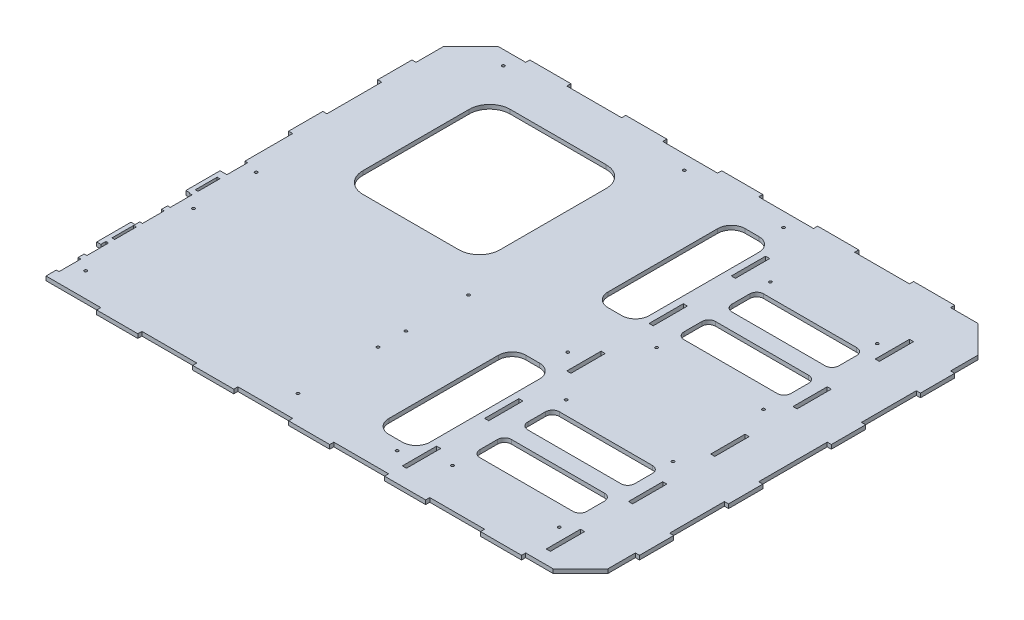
SolidWorks part; units mm, degrees
ref_plane "Front Plane" through (0, 0, 0) normal (0, 0, 1) x (1, 0, 0)
ref_plane "Top Plane" through (0, 0, 0) normal (0, 1, 0) x (1, 0, 0)
ref_plane "Right Plane" through (0, 0, 0) normal (1, 0, 0) x (0, 0, -1)
sketch "Sketch1" plane through (0, 0, 0) normal (0, 1, 0) x (1, 0, 0)
  line L0 (0, 0) -> (0, 310)
  line L1 (0, 310) -> (390, 310)
  line L2 (390, 310) -> (390, 0)
  line L3 (390, 0) -> (0, 0)
extrude "Boss-Extrude1" add sketch "Sketch1" along normal blind 3
sketch "Sketch2" plane through (0, 3, 0) normal (0, 1, 0) x (1, 0, 0)
  line L0 (0, 310) -> (40, 310) construction
  line L1 (390, 310) -> (0, 310) construction
  line L2 (40, 310) -> (70, 310) construction
  line L3 (70, 310) -> (110, 310) construction
  line L4 (110, 310) -> (140, 310) construction
  line L5 (140, 310) -> (180, 310) construction
  line L6 (180, 310) -> (210, 310) construction
  line L7 (210, 310) -> (250, 310) construction
  line L8 (250, 310) -> (280, 310) construction
  line L9 (280, 310) -> (320, 310) construction
  line L10 (320, 310) -> (350, 310) construction
  line L11 (350, 310) -> (390, 310) construction
  line L12 (40, 310) -> (40, 303)
  line L13 (40, 303) -> (70, 303)
  line L14 (70, 303) -> (70, 310)
  line L15 (70, 310) -> (40, 310)
  line L16 (110, 310) -> (110, 303)
  line L17 (110, 303) -> (140, 303)
  line L18 (140, 303) -> (140, 310)
  line L19 (140, 310) -> (110, 310)
  line L20 (180, 310) -> (180, 303)
  line L21 (180, 303) -> (210, 303)
  line L22 (210, 303) -> (210, 310)
  line L23 (210, 310) -> (180, 310)
  line L24 (250, 310) -> (250, 303)
  line L25 (250, 303) -> (280, 303)
  line L26 (280, 303) -> (280, 310)
  line L27 (280, 310) -> (250, 310)
  line L28 (320, 310) -> (320, 303)
  line L29 (320, 303) -> (350, 303)
  line L30 (350, 303) -> (350, 310)
  line L31 (350, 310) -> (320, 310)
  line L32 (0, 155) -> (390, 155) construction
  line L33 (0, 310) -> (0, 0) construction
  line L34 (390, 0) -> (390, 310) construction
  line L35 (350, 0) -> (320, 0)
  line L36 (350, 7) -> (350, 0)
  line L37 (320, 7) -> (350, 7)
  line L38 (320, 0) -> (320, 7)
  line L39 (280, 7) -> (280, 0)
  line L40 (280, 0) -> (250, 0)
  line L41 (250, 0) -> (250, 7)
  line L42 (250, 7) -> (280, 7)
  line L43 (210, 7) -> (210, 0)
  line L44 (210, 0) -> (180, 0)
  line L45 (180, 0) -> (180, 7)
  line L46 (180, 7) -> (210, 7)
  line L47 (110, 0) -> (110, 7)
  line L48 (140, 0) -> (110, 0)
  line L49 (140, 7) -> (140, 0)
  line L50 (110, 7) -> (140, 7)
  line L51 (40, 0) -> (40, 7)
  line L52 (70, 0) -> (40, 0)
  line L53 (70, 7) -> (70, 0)
  line L54 (40, 7) -> (70, 7)
  dimension "D1" = 30
  dimension "D2" = 40
  dimension "D3" = 40
  dimension "D4" = 30
  dimension "D5" = 40
  dimension "D6" = 30
  dimension "D7" = 40
  dimension "D8" = 30
  dimension "D9" = 40
  dimension "D10" = 30
  dimension "D11" = 40
extrude "Boss-Extrude2" add sketch "Sketch2" against normal blind 3
sketch "Sketch4" plane through (0, 3, 0) normal (0, 1, 0) x (1, 0, 0)
  line L0 (0, 310) -> (0, 270) construction
  line L1 (0, 310) -> (0, 0) construction
  line L2 (0, 270) -> (0, 245) construction
  line L3 (0, 245) -> (0, 205) construction
  line L4 (0, 205) -> (0, 180) construction
  line L5 (0, 180) -> (0, 130) construction
  line L6 (0, 130) -> (0, 105) construction
  line L7 (0, 105) -> (0, 65) construction
  line L8 (0, 65) -> (0, 40) construction
  line L9 (0, 40) -> (0, 0) construction
  line L10 (195, 310) -> (195, 0) construction
  line L13 (0, 270) -> (0, 245)
  line L14 (0, 245) -> (-3, 245)
  line L15 (-3, 245) -> (-3, 270)
  line L16 (-3, 270) -> (0, 270)
  line L17 (0, 205) -> (0, 180)
  line L18 (0, 180) -> (-3, 180)
  line L19 (-3, 180) -> (-3, 205)
  line L20 (-3, 205) -> (0, 205)
  line L21 (0, 40) -> (-3, 40)
  line L22 (-3, 40) -> (-3, 65)
  line L23 (-3, 65) -> (0, 65)
  line L24 (0, 65) -> (0, 40)
  line L25 (0, 130) -> (-3, 130)
  line L26 (-3, 130) -> (-3, 105)
  line L27 (-3, 105) -> (0, 105)
  line L28 (0, 105) -> (0, 130)
  line L45 (390, 310) -> (0, 310) construction
  line L46 (0, 0) -> (390, 0) construction
  line L47 (390, 40) -> (393, 40)
  line L48 (390, 65) -> (390, 40)
  line L49 (393, 40) -> (393, 65)
  line L50 (393, 65) -> (390, 65)
  line L51 (393, 105) -> (390, 105)
  line L52 (390, 105) -> (390, 130)
  line L53 (393, 130) -> (393, 105)
  line L54 (390, 130) -> (393, 130)
  line L55 (390, 180) -> (393, 180)
  line L56 (390, 205) -> (390, 180)
  line L57 (393, 205) -> (390, 205)
  line L58 (393, 180) -> (393, 205)
  line L59 (390, 245) -> (393, 245)
  line L60 (390, 270) -> (390, 245)
  line L61 (393, 245) -> (393, 270)
  line L62 (393, 270) -> (390, 270)
  dimension "D1" = 40
  dimension "D2" = 25
  dimension "D3" = 40
  dimension "D4" = 25
  dimension "D5" = 50
  dimension "D6" = 25
  dimension "D7" = 40
  dimension "D8" = 25
  dimension "D9" = 40
extrude "Boss-Extrude3" add sketch "Sketch4" against normal blind 3
sketch "Sketch7" plane through (0, 3, 0) normal (0, 1, 0) x (1, 0, 0)
  line L0 (0, 310) -> (0, 306) construction
  line L1 (0, 310) -> (0, 270) construction
  line L2 (0, 306) -> (0, 142.17) construction
  line L3 (0, 105) -> (0, 65) construction
  line L4 (0, 142.17) -> (0, 96.45) construction
  line L5 (0, 96.45) -> (0, 17.71) construction
  line L6 (0, 96.45) -> (11.16, 96.45) construction
  line L7 (0, 17.71) -> (11.16, 17.71) construction
  line L8 (0, 142.17) -> (11.16, 142.17) construction
  line L9 (0, 306) -> (34.02, 306) construction
  line L10 (34.02, 306) -> (34.02, 299.65) construction
  line L11 (34.02, 306) -> (166.1, 306) construction
  line L12 (166.1, 306) -> (166.1, 299.65) construction
  line L13 (166.1, 299.65) -> (166.1, 142.17) construction
  line L14 (166.1, 142.17) -> (166.1, 17.71) construction
  line L15 (166.1, 17.71) -> (166.1, 0) construction
  line L16 (0, 0) -> (390, 0) construction
  line L17 (166.1, 299.65) -> (166.1, 310) construction
  line L18 (390, 310) -> (0, 310) construction
  line L19 (0, 142.17) -> (166.1, 142.17) construction
  line L20 (166.1, 142.17) -> (238.49, 142.17) construction
  line L21 (11.16, 17.71) -> (166.1, 17.71) construction
  line L22 (0, 299.65) -> (238.49, 299.65) construction
  line L23 (11.16, 96.45) -> (166.1, 96.45) construction
  line L24 (166.1, 96.45) -> (166.1, 76.13) construction
  line L25 (166.1, 17.71) -> (238.49, 17.71) construction
  circle A0 centre (166.1, 299.65) radius 1
  circle A1 centre (34.02, 299.65) radius 1
  circle A2 centre (11.16, 142.17) radius 1
  circle A3 centre (11.16, 96.45) radius 1
  circle A4 centre (11.16, 17.71) radius 1
  circle A5 centre (166.1, 17.71) radius 1
  circle A6 centre (166.1, 142.17) radius 1
  circle A7 centre (238.49, 299.65) radius 1
  circle A8 centre (238.49, 142.17) radius 1
  circle A9 centre (238.49, 17.71) radius 1
  circle A10 centre (166.1, 76.13) radius 1
  circle A11 centre (166.1, 96.45) radius 1
  dimension "D10" = 157.48
  dimension "D12" = 6.35
  dimension "D14" = 154.94
  dimension "D1" = 4
  dimension "D2" = 163.83
  dimension "D3" = 45.72
  dimension "D4" = 78.74
  dimension "D5" = 11.16
  dimension "D6" = 11.16
  dimension "D7" = 11.16
  dimension "D8" = 34.02
  dimension "D9" = 132.08
  dimension "D11" = 124.46
  dimension "D13" = 6.35
  dimension "D15" = 72.39
  dimension "D16" = 72.39
extrude "Cut-Extrude3" cut sketch "Sketch7" against normal blind 3
sketch "Sketch9" plane through (0, 3, 0) normal (0, 1, 0) x (1, 0, 0)
  line L0 (195, 310) -> (195, 0) construction
  line L1 (390, 310) -> (0, 310) construction
  line L2 (0, 0) -> (390, 0) construction
  line L3 (0, 155) -> (390, 155) construction
  line L4 (0, 180) -> (0, 130) construction
  line L5 (390, 130) -> (390, 180) construction
  line L6 (195, 310) -> (210, 310) construction
  line L7 (210, 310) -> (250, 310) construction
  line L8 (250, 310) -> (280, 310) construction
  line L9 (280, 310) -> (320, 310) construction
  line L10 (320, 310) -> (350, 310) construction
  line L11 (195, 310) -> (180, 310) construction
  line L12 (180, 310) -> (140, 310) construction
  line L13 (140, 310) -> (110, 310) construction
  line L14 (110, 310) -> (70, 310) construction
  line L15 (40, 310) -> (70, 310)
  line L16 (40, 310) -> (40, 313)
  line L17 (40, 313) -> (70, 313)
  line L18 (70, 313) -> (70, 310)
  line L20 (110, 310) -> (110, 313)
  line L21 (110, 313) -> (140, 313)
  line L22 (140, 313) -> (140, 310)
  line L23 (140, 310) -> (110, 310)
  line L24 (180, 310) -> (210, 310)
  line L25 (210, 310) -> (210, 313)
  line L26 (210, 313) -> (180, 313)
  line L27 (180, 313) -> (180, 310)
  line L28 (250, 310) -> (280, 310)
  line L29 (280, 310) -> (280, 313)
  line L30 (280, 313) -> (250, 313)
  line L31 (250, 313) -> (250, 310)
  line L32 (320, 310) -> (350, 310)
  line L33 (350, 310) -> (350, 313)
  line L34 (350, 313) -> (320, 313)
  line L35 (320, 313) -> (320, 310)
  line L36 (70, 0) -> (40, 0) construction
  line L37 (110, 0) -> (70, 0) construction
  line L38 (140, 0) -> (110, 0) construction
  line L39 (180, 0) -> (140, 0) construction
  line L40 (195, 0) -> (180, 0) construction
  line L41 (320, 0) -> (350, 0) construction
  line L42 (280, 0) -> (320, 0) construction
  line L43 (250, 0) -> (280, 0) construction
  line L44 (210, 0) -> (250, 0) construction
  line L45 (195, 0) -> (210, 0) construction
  line L46 (320, -3) -> (320, 0)
  line L47 (350, -3) -> (320, -3)
  line L48 (350, 0) -> (350, -3)
  line L49 (320, 0) -> (350, 0)
  line L50 (250, -3) -> (250, 0)
  line L51 (280, -3) -> (250, -3)
  line L52 (280, 0) -> (280, -3)
  line L53 (250, 0) -> (280, 0)
  line L54 (180, -3) -> (180, 0)
  line L55 (210, -3) -> (180, -3)
  line L56 (210, 0) -> (210, -3)
  line L57 (180, 0) -> (210, 0)
  line L58 (140, 0) -> (110, 0)
  line L59 (140, -3) -> (140, 0)
  line L60 (110, -3) -> (140, -3)
  line L61 (110, 0) -> (110, -3)
  line L62 (70, 0) -> (40, 0)
  line L63 (70, -3) -> (70, 0)
  line L64 (40, -3) -> (70, -3)
  line L65 (40, 0) -> (40, -3)
  dimension "D1" = 15
  dimension "D2" = 15
  dimension "D3" = 40
  dimension "D4" = 30
  dimension "D5" = 40
  dimension "D6" = 30
  dimension "D7" = 40
  dimension "D8" = 30
  dimension "D9" = 40
  dimension "D10" = 30
extrude "Boss-Extrude4" add sketch "Sketch9" against normal blind 3
sketch "Sketch5" plane through (0, 3, 0) normal (0, 1, 0) x (1, 0, 0)
  line L0 (390, 310) -> (390, 290) construction
  line L1 (390, 270) -> (390, 310) construction
  line L2 (390, 290) -> (370, 290) construction
  line L3 (370, 290) -> (370, 310) construction
  line L4 (390, 310) -> (350, 310) construction
  line L5 (370, 310) -> (390, 310) construction
  line L6 (370, 310) -> (390, 310)
  line L7 (390, 310) -> (390, 290)
  line L8 (390, 290) -> (370, 310)
  line L9 (390, 0) -> (390, 20)
  line L10 (390, 0) -> (390, 40) construction
  line L14 (390, 0) -> (370, 0)
  line L15 (0, 0) -> (40, 0) construction
  line L16 (370, 0) -> (390, 20)
extrude "Cut-Extrude1" cut sketch "Sketch5" against normal blind 20
sketch "Sketch10" plane through (0, 3, 0) normal (0, 1, 0) x (1, 0, 0)
  line L0 (0, 310) -> (20, 310)
  line L1 (370, 310) -> (350, 310) construction
  line L2 (0, 310) -> (0, 290)
  line L3 (0, 310) -> (0, 270) construction
  line L4 (0, 290) -> (20, 310)
extrude "Cut-Extrude4" cut sketch "Sketch10" against normal blind 3
sketch "Sketch11" plane through (0, 3, 0) normal (0, 1, 0) x (1, 0, 0)
  line L0 (166.1, 299.65) -> (215.1, 299.65) construction
  line L1 (215.1, 310) -> (215.1, 0) construction
  line L2 (370, 310) -> (350, 310) construction
  line L3 (0, 0) -> (40, 0) construction
  line L4 (390, 225) -> (250, 225) construction
  line L5 (390, 205) -> (390, 245) construction
  line L6 (215.1, 0) -> (250, 0) construction
  line L7 (250, 0) -> (250, 310) construction
  line L8 (232.55, 0) -> (232.55, 25) construction
  line L9 (232.55, 25) -> (232.55, 125) construction
  line L10 (250, 310) -> (232.55, 310) construction
  line L11 (232.55, 310) -> (215.1, 310) construction
  line L12 (232.55, 310) -> (232.55, 285) construction
  line L13 (232.55, 285) -> (232.55, 185) construction
  line L14 (232.55, 185) -> (215.1, 185)
  line L15 (215.1, 185) -> (215.1, 285)
  line L16 (215.1, 285) -> (245.1, 285)
  line L17 (245.1, 285) -> (245.1, 185)
  line L18 (245.1, 185) -> (232.55, 185)
  line L19 (215.1, 125) -> (245.1, 125)
  line L20 (245.1, 125) -> (245.1, 25)
  line L21 (245.1, 25) -> (215.1, 25)
  line L22 (215.1, 25) -> (215.1, 125)
  dimension "D2" = 100
  dimension "D3" = 100
  dimension "D4" = 25
extrude "Cut-Extrude5" cut sketch "Sketch11" against normal blind 10
fillet "Fillet1" radius 10 8 edges at (215.1, 1.5, -25) (245.1, 1.5, -25) (245.1, 1.5, -125) (215.1, 1.5, -125) (245.1, 1.5, -185) (215.1, 1.5, -185) (245.1, 1.5, -285) (215.1, 1.5, -285)
sketch "Sketch12" plane through (0, 3, 0) normal (0, 1, 0) x (1, 0, 0)
  line L0 (250, 70) -> (250, 35) construction
  line L1 (210, 310) -> (250, 310) construction
  line L2 (250, 275) -> (250, 250) construction
  line L3 (250, 250) -> (250, 215) construction
  line L4 (250, 215) -> (250, 190) construction
  line L5 (250, 190) -> (250, 155) construction
  line L6 (250, 155) -> (250, 130) construction
  line L7 (250, 130) -> (250, 95) construction
  line L8 (250, 95) -> (250, 70) construction
  line L9 (250, 35) -> (250, 10) construction
  line L10 (250, 275) -> (250, 250)
  line L11 (250, 250) -> (253, 250)
  line L12 (253, 250) -> (253, 275)
  line L13 (253, 275) -> (250, 275)
  line L14 (250, 190) -> (250, 215)
  line L15 (250, 215) -> (253, 215)
  line L16 (253, 215) -> (253, 190)
  line L17 (253, 190) -> (250, 190)
  line L18 (250, 130) -> (250, 155)
  line L19 (250, 155) -> (253, 155)
  line L20 (253, 155) -> (253, 130)
  line L21 (253, 130) -> (250, 130)
  line L22 (250, 95) -> (250, 70)
  line L23 (250, 70) -> (253, 70)
  line L24 (253, 70) -> (253, 95)
  line L25 (253, 95) -> (250, 95)
  line L26 (250, 35) -> (250, 10)
  line L27 (250, 10) -> (253, 10)
  line L28 (253, 10) -> (253, 35)
  line L29 (253, 35) -> (250, 35)
  line L30 (253, 202.5) -> (355, 202.5) construction
  line L31 (304, 202.5) -> (304, 295.3577) construction
  line L32 (358, 10) -> (355, 10)
  line L33 (358, 35) -> (358, 10)
  line L34 (355, 10) -> (355, 35)
  line L35 (355, 35) -> (358, 35)
  line L36 (358, 70) -> (355, 70)
  line L37 (355, 70) -> (355, 95)
  line L38 (358, 95) -> (358, 70)
  line L39 (355, 95) -> (358, 95)
  line L40 (355, 130) -> (358, 130)
  line L41 (358, 130) -> (358, 155)
  line L42 (355, 155) -> (355, 130)
  line L43 (358, 155) -> (355, 155)
  line L44 (358, 190) -> (358, 215)
  line L45 (355, 190) -> (358, 190)
  line L46 (355, 215) -> (355, 190)
  line L47 (358, 215) -> (355, 215)
  line L48 (358, 250) -> (355, 250)
  line L49 (355, 250) -> (355, 275)
  line L50 (358, 275) -> (358, 250)
  line L51 (355, 275) -> (358, 275)
  line L53 (250, 310) -> (250, 313) construction
  line L54 (250, 313) -> (250, 310) construction
  line L56 (250, 310) -> (250, 275) construction
  dimension "D2" = 25
  dimension "D3" = 35
  dimension "D4" = 25
  dimension "D5" = 35
  dimension "D6" = 25
  dimension "D7" = 35
  dimension "D8" = 25
  dimension "D9" = 35
  dimension "D10" = 25
extrude "Cut-Extrude6" cut sketch "Sketch12" against normal through all
sketch "Sketch13" plane through (0, 3, 0) normal (0, 1, 0) x (1, 0, 0)
  line L0 (262, 35) -> (262, 115) construction
  line L1 (355, 35) -> (352, 35) construction
  line L2 (268, 26) -> (268, 28.5) construction
  line L3 (262, 35) -> (262, 20) construction
  line L4 (262, 115) -> (352, 115) construction
  line L5 (307, 35) -> (307, 68) construction
  line L6 (352, 20) -> (262, 20) construction
  line L7 (262, 115) -> (268, 115) construction
  line L8 (268, 115) -> (268, 111.5) construction
  line L9 (352, 115) -> (352, 111.5) construction
  line L10 (352, 111.5) -> (346, 111.5) construction
  line L11 (352, 20) -> (352, 26) construction
  line L12 (352, 26) -> (346, 26) construction
  line L13 (262, 20) -> (268, 20) construction
  line L14 (268, 20) -> (268, 26) construction
  line L15 (307, 68) -> (390, 68) construction
  line L16 (307, 68) -> (307, 101) construction
  line L17 (307, 101) -> (268, 101) construction
  line L18 (390, 65) -> (390, 105) construction
  line L19 (355, 35) -> (355, 115) construction
  line L20 (355, 68) -> (341, 68) construction
  line L21 (355, 35) -> (340, 35) construction
  line L22 (355, 101) -> (341, 101) construction
  line L23 (346, 26) -> (346, 28.5) construction
  line L24 (268, 111.5) -> (346, 28.5) construction
  line L25 (268, 28.5) -> (346, 111.5) construction
  circle A2 centre (268, 111.5) radius 1
  circle A3 centre (346, 111.5) radius 1
  circle A4 centre (268, 28.5) radius 1
  circle A5 centre (346, 28.5) radius 1
extrude "Cut-Extrude7" cut sketch "Sketch13" against normal blind 10
sketch "Sketch14" plane through (0, 3, 0) normal (0, 1, 0) x (1, 0, 0)
  line L0 (253, 35) -> (253, 34) construction
  line L2 (253, 34) -> (366.4963, 34) construction
  line L4 (253, 10) -> (253, 35) construction
  line L5 (253, 190) -> (253, 183) construction
  line L6 (253, 183) -> (372.1239, 183) construction
  line L7 (268, 183) -> (268, 177.5) construction
  line L8 (346, 183) -> (346, 177.5) construction
  line L9 (346, 177.5) -> (346, 260.5) construction
  line L10 (268, 177.5) -> (268, 260.5) construction
  line L11 (268, 260.5) -> (346, 177.5) construction
  line L12 (268, 177.5) -> (346, 260.5) construction
  circle A1 centre (268, 177.5) radius 1
  circle A2 centre (346, 177.5) radius 1
  circle A3 centre (268, 260.5) radius 1
  circle A4 centre (346, 260.5) radius 1
  dimension "D1" = 83
  dimension "D2" = 83
  dimension "D3" = 7
  dimension "D4" = 5.5
  dimension "D5" = 5.5
extrude "Cut-Extrude8" cut sketch "Sketch14" against normal through all
sketch "Sketch15" plane through (0, 3, 0) normal (0, 1, 0) x (1, 0, 0)
  line L0 (346, 28.5) -> (346, 34) construction
  line L1 (299.5, 34) -> (346, 34) construction
  line L2 (299.5, 34) -> (299.5, 67) construction
  line L3 (299.5, 67) -> (253, 67) construction
  line L4 (299.5, 67) -> (299.5, 100) construction
  line L5 (299.5, 100) -> (253, 100) construction
  line L6 (346, 177.5) -> (346, 183) construction
  line L7 (346, 183) -> (253, 183) construction
  line L8 (299.5, 183) -> (299.5, 216) construction
  line L9 (299.5, 216) -> (253, 216) construction
  line L10 (299.5, 216) -> (299.5, 250) construction
  line L11 (299.5, 250) -> (253, 250) construction
sketch "Sketch16" plane through (0, 3, 0) normal (0, 1, 0) x (1, 0, 0)
  line L0 (346, 28.5) -> (346, 43.5) construction
  line L1 (346, 43.5) -> (346, 66.5) construction
  line L2 (346, 66.5) -> (346, 78.5) construction
  line L3 (346, 78.5) -> (346, 101.5) construction
  line L4 (268, 28.5) -> (268, 43.5) construction
  line L5 (268, 43.5) -> (268, 66.5) construction
  line L6 (268, 66.5) -> (268, 78.5) construction
  line L7 (268, 78.5) -> (268, 101.5) construction
  line L8 (268, 43.5) -> (346, 43.5)
  line L9 (346, 43.5) -> (346, 66.5)
  line L10 (346, 66.5) -> (268, 66.5)
  line L11 (268, 66.5) -> (268, 43.5)
  line L12 (268, 78.5) -> (346, 78.5)
  line L13 (346, 78.5) -> (346, 101.5)
  line L14 (346, 101.5) -> (268, 101.5)
  line L15 (268, 101.5) -> (268, 78.5)
  line L16 (346, 177.5) -> (346, 192.5) construction
  line L17 (346, 192.5) -> (346, 215.5) construction
  line L18 (346, 215.5) -> (346, 227.5) construction
  line L19 (346, 227.5) -> (346, 250.5) construction
  line L20 (346, 192.5) -> (268, 192.5)
  line L21 (268, 192.5) -> (268, 215.5)
  line L22 (268, 215.5) -> (346, 215.5)
  line L23 (346, 215.5) -> (346, 192.5)
  line L24 (346, 227.5) -> (268, 227.5)
  line L25 (268, 227.5) -> (268, 250.5)
  line L26 (268, 250.5) -> (346, 250.5)
  line L27 (346, 250.5) -> (346, 227.5)
extrude "Cut-Extrude9" cut sketch "Sketch16" against normal blind 10
fillet "Fillet2" radius 5 16 edges at (268, 1.5, -66.5) (346, 1.5, -66.5) (346, 1.5, -43.5) (268, 1.5, -43.5) (268, 1.5, -78.5) (346, 1.5, -78.5) (346, 1.5, -101.5) (268, 1.5, -101.5) (268, 1.5, -227.5) (268, 1.5, -192.5) (346, 1.5, -227.5) (346, 1.5, -192.5) (346, 1.5, -215.5) (346, 1.5, -250.5) (268, 1.5, -215.5) (268, 1.5, -250.5)
sketch "Sketch18" plane through (0, 3, 0) normal (0, 1, 0) x (1, 0, 0)
  line L0 (34.02, 299.65) -> (166.1, 299.65) construction
  line L1 (166.1, 142.17) -> (11.16, 142.17) construction
  line L2 (99.06, 167.17) -> (149.06, 167.17)
  line L3 (100.06, 299.65) -> (99.06, 274.65) construction
  line L4 (99.06, 142.17) -> (99.06, 167.17) construction
  line L5 (149.06, 167.17) -> (149.06, 274.65)
  line L6 (149.06, 274.65) -> (49.06, 274.65)
  line L7 (49.06, 274.65) -> (49.06, 167.17)
  line L8 (49.06, 167.17) -> (99.06, 167.17)
extrude "Cut-Extrude10" cut sketch "Sketch18" against normal blind 10
fillet "Fillet3" radius 15 4 edges at (49.06, 1.5, -167.17) (149.06, 1.5, -167.17) (149.06, 1.5, -274.65) (49.06, 1.5, -274.65)
sketch "Sketch19" plane through (0, 3, 0) normal (0, 1, 0) x (1, 0, 0)
  line L0 (0, 130) -> (0, 145.15) construction
  line L1 (0, 180) -> (0, 130) construction
  line L2 (0, 145.15) -> (0, 129.25) construction
  line L3 (0, 129.25) -> (0, 124.86) construction
  line L4 (0, 124.86) -> (0, 108.96) construction
  line L5 (0, 108.96) -> (0, 104.57) construction
  line L6 (0, 104.57) -> (0, 88.67) construction
  line L7 (0, 105) -> (0, 65) construction
  line L8 (0, 88.67) -> (0, 84.28) construction
  line L9 (0, 84.28) -> (0, 68.38) construction
  line L10 (0, 68.38) -> (0, 63.99) construction
  line L11 (0, 63.99) -> (0, 48.09) construction
  line L12 (0, 40) -> (0, 0) construction
  line L13 (0, 48.09) -> (0, 43.7) construction
  line L14 (0, 43.7) -> (0, 27.8) construction
  line L15 (0, 27.8) -> (0, 23.41) construction
  line L16 (0, 23.41) -> (0, 7.51) construction
  line L17 (0, 145.15) -> (2, 145.15) construction
  line L18 (0, 145.15) -> (2, 145.15)
  line L19 (2, 145.15) -> (2, 130)
  line L20 (2, 130) -> (0, 130)
  line L21 (0, 130) -> (0, 145.15)
  line L22 (0, 124.86) -> (2, 124.86)
  line L23 (2, 124.86) -> (2, 108.96)
  line L24 (2, 108.96) -> (0, 108.96)
  line L25 (0, 108.96) -> (0, 124.86)
  line L26 (0, 88.67) -> (2, 88.67)
  line L27 (2, 88.67) -> (2, 104.57)
  line L28 (2, 104.57) -> (0, 104.57)
  line L29 (0, 104.57) -> (0, 88.67)
  line L30 (0, 84.28) -> (2, 84.28)
  line L31 (2, 84.28) -> (2, 68.38)
  line L32 (2, 68.38) -> (0, 68.38)
  line L33 (0, 68.38) -> (0, 84.28)
  line L34 (0, 23.41) -> (2, 23.41)
  line L35 (2, 23.41) -> (2, 7.51)
  line L36 (2, 7.51) -> (0, 7.51)
  line L37 (0, 7.51) -> (0, 23.41)
  line L38 (0, 27.8) -> (2, 27.8)
  line L39 (2, 27.8) -> (2, 43.7)
  line L40 (2, 43.7) -> (0, 43.7)
  line L41 (0, 43.7) -> (0, 27.8)
  line L42 (0, 48.09) -> (2, 48.09)
  line L43 (2, 48.09) -> (2, 63.99)
  line L44 (2, 63.99) -> (0, 63.99)
  line L45 (0, 63.99) -> (0, 48.09)
  dimension "D1" = 15.15
  dimension "D2" = 15.9
  dimension "D3" = 4.39
  dimension "D4" = 15.9
  dimension "D5" = 15.9
  dimension "D6" = 4.39
  dimension "D7" = 4.39
  dimension "D8" = 15.9
  dimension "D9" = 4.39
  dimension "D10" = 15.9
  dimension "D11" = 4.39
  dimension "D12" = 15.9
  dimension "D13" = 4.39
  dimension "D14" = 15.9
extrude "Cut-Extrude11" cut sketch "Sketch19" against normal through all
